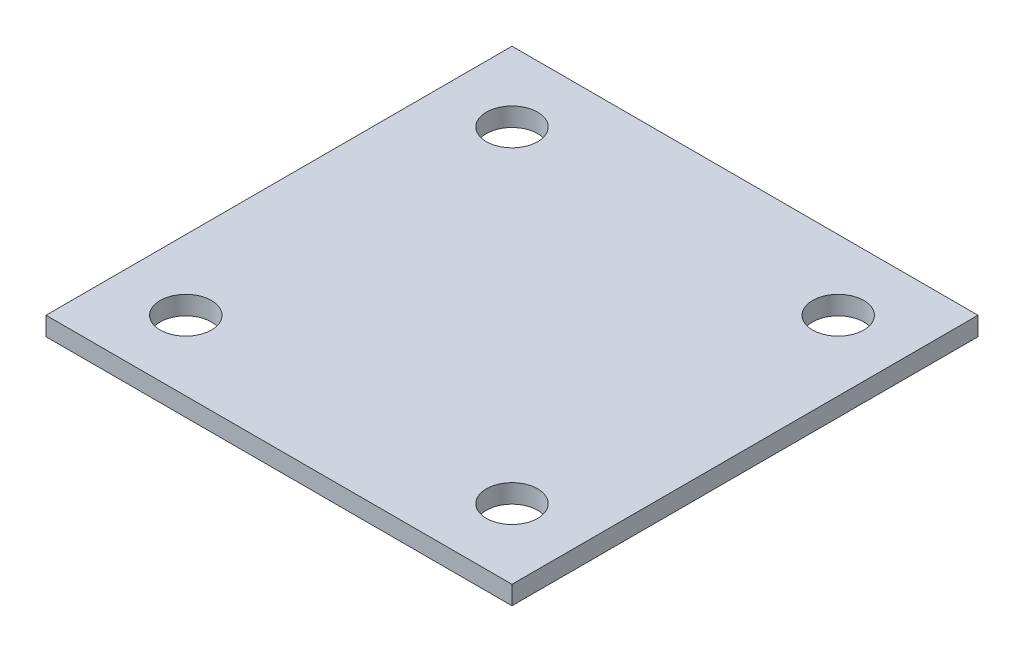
SolidWorks part; units mm, degrees
ref_plane "Спереди" through (0, 0, 0) normal (0, 0, 1) x (1, 0, 0)
ref_plane "Сверху" through (0, 0, 0) normal (0, 1, 0) x (1, 0, 0)
ref_plane "Справа" through (0, 0, 0) normal (1, 0, 0) x (0, 0, -1)
other "Configuration Table"
sketch "Эскиз1" plane through (0, 0, 0) normal (0, 1, 0) x (1, 0, 0)
  line L1 (-50, -50) -> (50, -50)
  line L2 (-50, -50) -> (-50, 50)
  line L3 (-50, 50) -> (50, 50)
  line L4 (50, -50) -> (50, 50)
  circle A0 centre (-35, -35) radius 5.5
  circle A1 centre (-35, 35) radius 5.5
  circle A2 centre (35, -35) radius 5.5
  circle A3 centre (35, 35) radius 5.5
extrude "Пластина 100х100х4, 4 отв. Ø11" add sketch "Эскиз1" along normal blind 4
